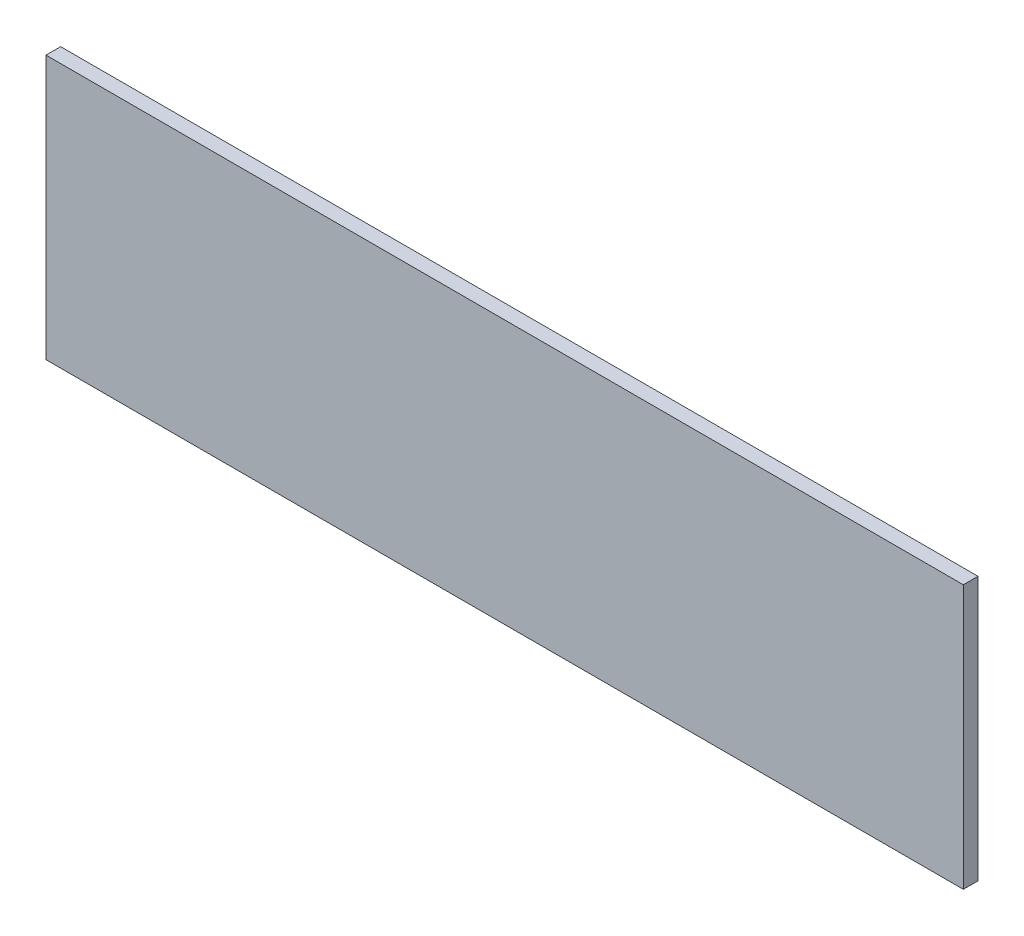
SolidWorks part; units mm, degrees
ref_plane "Plan de face" through (0, 0, 0) normal (0, 0, 1) x (1, 0, 0)
ref_plane "Plan de dessus" through (0, 0, 0) normal (0, 1, 0) x (1, 0, 0)
ref_plane "Plan de droite" through (0, 0, 0) normal (1, 0, 0) x (0, 0, -1)
sketch "Esquisse1" plane through (0, 0, 0) normal (0, 0, 1) x (1, 0, 0)
  line L1 (0, 0) -> (-6260, 0)
  line L2 (0, 0) -> (0, 1800)
  line L3 (0, 1800) -> (-6260, 1800)
  line L4 (-6260, 0) -> (-6260, 1800)
  dimension "D1" = 1800
  dimension "D2" = 6260
extrude "Boss.-Extru.1" add sketch "Esquisse1" against normal blind 100
